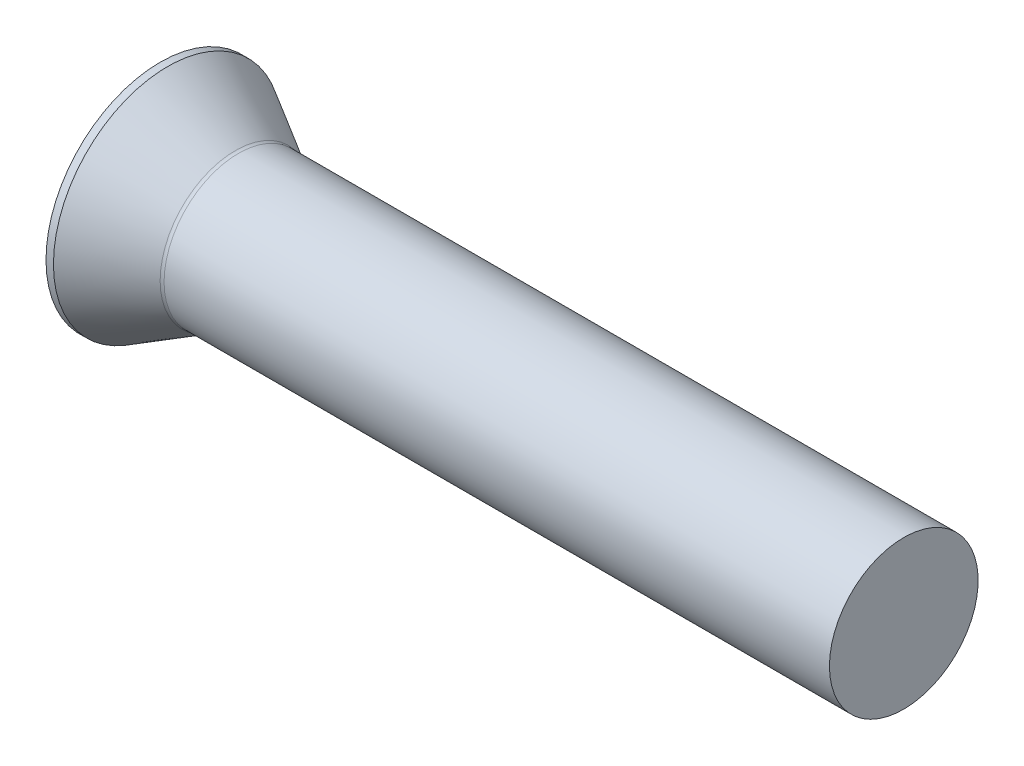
SolidWorks part; units mm, degrees
ref_plane "Front" through (0, 0, 0) normal (0, 0, 1) x (1, 0, 0)
ref_plane "Top" through (0, 0, 0) normal (0, 1, 0) x (1, 0, 0)
ref_plane "Right" through (0, 0, 0) normal (1, 0, 0) x (0, 0, -1)
sketch "Sketch1" plane through (0, 0, 0) normal (0, 0, 1) x (1, 0, 0)
  line L0 (-34.7299, 0) -> (14.8285, 0) construction
  line L1 (62.625, 0) -> (62.625, 6)
  line L2 (62.625, 6) -> (8.934, 6)
  line L3 (8.684, 6.067) -> (3.225, 9.2187)
  line L4 (3.225, 9.2187) -> (2.625, 9.2187)
  line L5 (62.625, 0) -> (0, 0)
  line L6 (8.684, 6.067) -> (8.8, 6) construction
  line L7 (8.934, 6) -> (8.8, 6) construction
  line L8 (0, 0) -> (0, -9.1875) construction
  arc A0 (2.625, 9.2187) -> (0, 0) centre (17.5, 0) ccw
  arc A1 (8.934, 6) -> (8.684, 6.067) centre (8.934, 6.5) cw
  point P12 (8.8, 6)
  point P13 (8.8, 6)
  dimension "R" = 17.5
  dimension "r1" = 0.5
  dimension "d" = 12
  dimension "l" = 60
  dimension "D2" = 30
  dimension "b" = 0.6
  dimension "k" = 8.8
revolve "Base-Revolve" add sketch "Sketch1" angle 360 about L0
